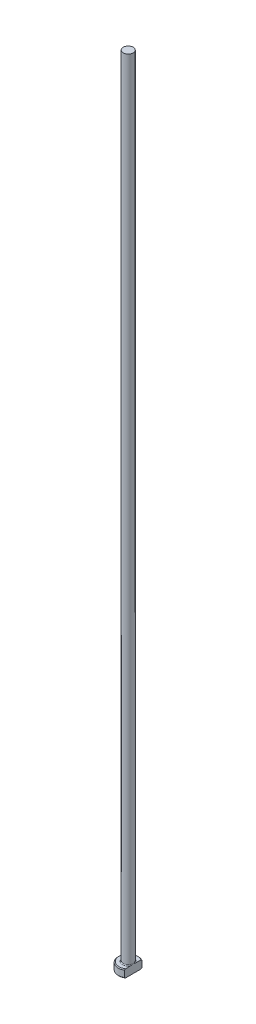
SolidWorks part; units mm, degrees
ref_plane "Front Plane" through (0, 0, 0) normal (0, 0, 1) x (1, 0, 0)
ref_plane "Top Plane" through (0, 0, 0) normal (0, 1, 0) x (1, 0, 0)
ref_plane "Right Plane" through (0, 0, 0) normal (1, 0, 0) x (0, 0, -1)
sketch "Sketch1" plane through (0, 0, 0) normal (0, 0, 1) x (1, 0, 0)
  line L0 (0, 259.9588) -> (0, -15.1925) construction
  line L1 (0, 0) -> (-2.5, 0)
  line L2 (-2.5, 0) -> (-2.5, 2)
  line L3 (-2.5, 2) -> (-1.25, 2)
  line L4 (-1.25, 2) -> (-1.25, 200)
  line L5 (-1.25, 200) -> (0, 200)
  line L6 (0, 200) -> (0, 0)
  dimension "L" = 200
  dimension "H" = 5
  dimension "T" = 2
  dimension "D" = 2.5
revolve "Revolve1" add sketch "Sketch1" angle 360 about L0
chamfer "Chamfer1" distance 0.2 angle 45 2 edges at (0, 2, 2.5) (0, 0, 2.5)
fillet "Fillet1" radius 0.2 1 edges at (0, 2, 1.25)
sketch "Sketch2" plane through (0, 0, 0) normal (0, 1, 0) x (1, 0, 0)
  line L0 (1.25, 2.1651) -> (1.25, -2.1651)
  circle A0 centre (0, 0) radius 2.5 construction
  arc A1 (1.25, -2.1651) -> (1.25, 2.1651) centre (0, 0) ccw
  circle A2 centre (0, 0) radius 1.25 construction
extrude "KEY" cut sketch "Sketch2" along normal through all
